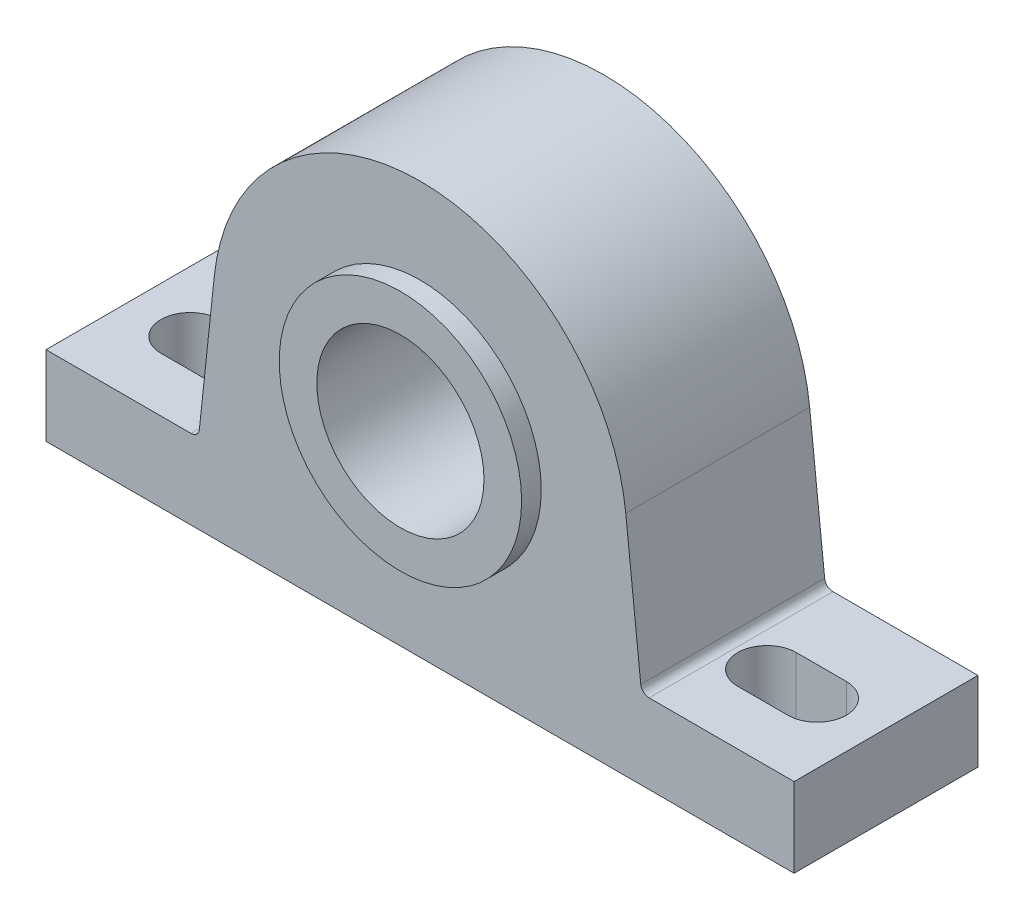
SolidWorks part; units mm, degrees
ref_plane "Face" through (0, 0, 0) normal (0, 0, 1) x (1, 0, 0)
ref_plane "Dessus" through (0, 0, 0) normal (0, 1, 0) x (1, 0, 0)
ref_plane "Droite" through (0, 0, 0) normal (1, 0, 0) x (0, 0, -1)
sketch "Esquisse1" plane through (0, 0, 0) normal (0, 0, 1) x (1, 0, 0)
  line L0 (0, 92.3792) -> (0, -120.2815) construction
  line L1 (113.3059, 0) -> (-150.2576, 0) construction
  line L2 (-89.5, -49.2) -> (89.5, -49.2)
  line L3 (-89.5, -49.2) -> (-89.5, -30.1981)
  line L4 (-89.5, -30.1981) -> (-54.798, -30.1981)
  line L5 (-52.8091, -28.4101) -> (-49.2208, 5.25)
  line L6 (89.5, -49.2) -> (89.5, -30.2)
  line L7 (89.5, -30.2) -> (54.7981, -30.2)
  line L8 (52.8094, -28.412) -> (49.2208, 5.25)
  line L9 (-124.6851, 5.25) -> (66.2151, 5.25) construction
  arc A0 (49.2208, 5.25) -> (-49.2208, 5.25) centre (0, 0) ccw
  arc A1 (-52.8091, -28.4101) -> (-54.798, -30.1981) centre (-54.7978, -28.1981) cw
  arc A2 (54.7981, -30.2) -> (52.8094, -28.412) centre (54.7981, -28.2) cw
  circle A3 centre (0, 0) radius 20
  point P18 (-53, -30.2008)
  point P21 (53, -30.2)
  dimension "D1" = 99
  dimension "D11" = 2
  dimension "D10" = 40
  dimension "D2" = 49.2
  dimension "D3" = 19
  dimension "D4" = 5.25
  dimension "D5" = 89.5
  dimension "D6" = 89.5
  dimension "D7" = 36.5
  dimension "D8" = 36.5
  dimension "D9" = 19.0019
extrude "Base-Extrusion" add sketch "Esquisse1" against normal blind 44
sketch "Esquisse2" plane through (0, -30.1981, 0) normal (0, 1, 0) x (-1, 0, 0)
  line L0 (97.5656, -20) -> (-99.9813, -20) construction
  line L1 (0, 40.807) -> (0, -92.6022) construction
  line L2 (0, -44) -> (0, 0) construction
  line L3 (-69, -72.9972) -> (-69, 29.2656) construction
  line L4 (69, -67.8974) -> (69, 32.7777) construction
  line L5 (-89.5, -44) -> (-54.7981, -44) construction
  line L6 (75, -27) -> (63, -27)
  line L7 (75, -13) -> (63, -13)
  line L8 (-63, -27) -> (-75, -27)
  line L9 (-75, -13) -> (-63, -13)
  arc A0 (-63, -27) -> (-63, -13) centre (-63, -20) ccw
  arc A1 (-75, -27) -> (-75, -13) centre (-75, -20) cw
  arc A2 (63, -27) -> (63, -13) centre (63, -20) cw
  arc A3 (75, -27) -> (75, -13) centre (75, -20) ccw
  dimension "D1" = 69
  dimension "D2" = 69
  dimension "D3" = 24
  dimension "D4" = 7
  dimension "D5" = 7
  dimension "D6" = 7
  dimension "D7" = 6
  dimension "D8" = 6
  dimension "D9" = 6
  dimension "D10" = 6
extrude "Enlèv. mat.-Extru.1" cut sketch "Esquisse2" against normal blind 44
sketch "Esquisse3" plane through (0, 0, 0) normal (0, 0, 1) x (1, 0, 0)
  circle A0 centre (0, 0) radius 29
  circle A1 centre (0, 0) radius 20
  dimension "D1" = 58
extrude "Boss.-Extru.1" add sketch "Esquisse3" along normal blind 4.7
